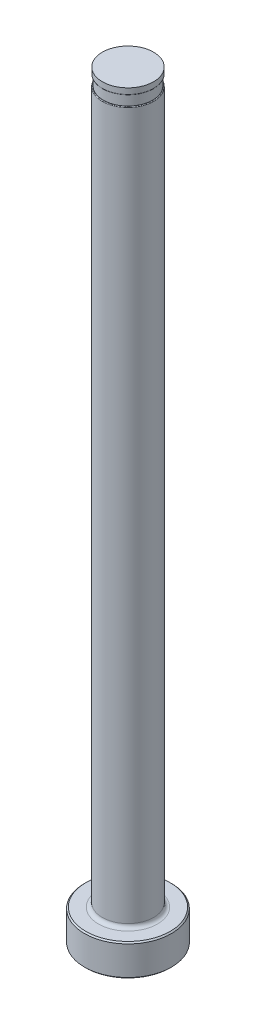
SolidWorks part; units mm, degrees
ref_plane "Front Plane" through (0, 0, 0) normal (0, 0, 1) x (1, 0, 0)
ref_plane "Top Plane" through (0, 0, 0) normal (0, 1, 0) x (1, 0, 0)
ref_plane "Right Plane" through (0, 0, 0) normal (1, 0, 0) x (0, 0, -1)
other "Configuration Table"
sketch "Sketch1" plane through (0, 0, 0) normal (0, 0, 1) x (1, 0, 0)
  line L0 (0, 259.9588) -> (0, -15.1925) construction
  line L1 (0, 0) -> (-8.7249, 0)
  line L2 (-8.7249, 0) -> (-8.7249, 6.35)
  line L3 (-8.7249, 6.35) -> (-5.1587, 6.35)
  line L4 (-5.1587, 6.35) -> (-5.1587, 152.4)
  line L5 (-5.1587, 152.4) -> (0, 152.4)
  line L6 (0, 152.4) -> (0, 0)
  dimension "L" = 152.4
  dimension "H" = 17.4498
  dimension "T" = 6.35
  dimension "D" = 10.3175
revolve "Revolve1" add sketch "Sketch1" angle 360 about L0
chamfer "Chamfer1" distance 0.254 angle 45 2 edges at (0, 6.35, 8.7249) (0, 0, 8.7249)
fillet "Fillet1" radius 0.762 1 edges at (0, 6.35, 5.1587)
sketch "Sketch2" plane through (0, 0, 0) normal (0, 0, 1) x (1, 0, 0)
  line L0 (-5.1587, 152.4) -> (-5.1587, 7.112) construction
  line L1 (-5.1587, 151.13) -> (-4.9555, 151.13)
  line L2 (-5.1587, 151.13) -> (-5.1587, 149.098)
  line L3 (-5.1587, 149.098) -> (-4.9555, 149.098)
  line L4 (-4.9555, 151.13) -> (-4.9555, 149.098)
  line L5 (5.1587, 152.4) -> (-5.1587, 152.4) construction
  line L6 (0, 153.4483) -> (0, 147.3282) construction
  dimension "D1" = 2.032
  dimension "N" = 1.27
  dimension "FD" = 0.2032
  dimension "D3" = 9.9111
revolve "Vent Relief" cut sketch "Sketch2" angle 360 about L6
sketch "Sketch3" plane through (0, 0, 0) normal (0, 0, 1) x (1, 0, 0)
  line L0 (-4.9555, 150.114) -> (-4.9555, 86.614)
  line L1 (-4.9555, 151.13) -> (-4.9555, 149.098) construction
  line L2 (-5.1587, 149.098) -> (-5.1587, 7.112) construction
  line L3 (-5.1587, 85.4964) -> (-5.1587, 150.114)
  line L4 (-5.1587, 150.114) -> (-4.9555, 150.114)
  arc A0 (-4.9555, 86.614) -> (-5.1587, 85.4964) centre (-8.1305, 86.614) cw
  dimension "D1" = 3.175
  dimension "D2" = 63.5
extrude "D-Slot" cut sketch "Sketch3" against normal through all both and the other way through all
sketch "Sketch5" plane through (0, 0, 0) normal (0, 0, 1) x (1, 0, 0)
  line L0 (-5.1587, 151.13) -> (5.1587, 151.13) construction
  line L1 (-5.1587, 152.4) -> (-5.146, 152.4)
  line L2 (-5.1587, 152.4) -> (-5.1587, 151.13)
  line L3 (-5.1587, 151.13) -> (-5.146, 151.13)
  line L4 (-5.146, 152.4) -> (-5.146, 151.13)
  line L5 (0, 152.6877) -> (0, 150.5771) construction
  dimension "VP" = 0.0127
revolve "Vent Diameter" cut sketch "Sketch5" angle 360 about L5
fillet "Fillet2" radius 0.127 2 edges at (5.1587, 149.098, 0) (0, 151.13, 5.146)
sketch "Pocket Sketch" plane through (0, 0, 0) normal (0, 0, 1) x (1, 0, 0)
  line L0 (-9.1218, 0) -> (-9.1218, 6.3754)
  line L1 (-9.1218, 6.3754) -> (-6.1192, 6.3754)
  line L2 (-5.3572, 7.1374) -> (-5.3572, 22.225)
  line L3 (-5.3572, 22.225) -> (0, 22.225)
  line L4 (0, 22.225) -> (0, 0)
  line L5 (0, 0) -> (-9.1218, 0)
  line L6 (0, 12.6104) -> (0, -2.4989) construction
  line L7 (-8.7249, 6.096) -> (-8.7249, 0.254) construction
  line L8 (8.4709, 6.35) -> (-8.4709, 6.35) construction
  line L9 (-5.1587, 85.4964) -> (-5.1587, 7.112) construction
  line L10 (-6.1192, 6.3754) -> (-5.3572, 7.1374)
  point P3 (-5.3572, 6.3754)
  dimension "D1" = 18.2435
  dimension "D2" = 0.3969
  dimension "D3" = 0.0254
  dimension "D4" = 0.1984
  dimension "D5" = 10.7144
  dimension "D6" = 22.225
